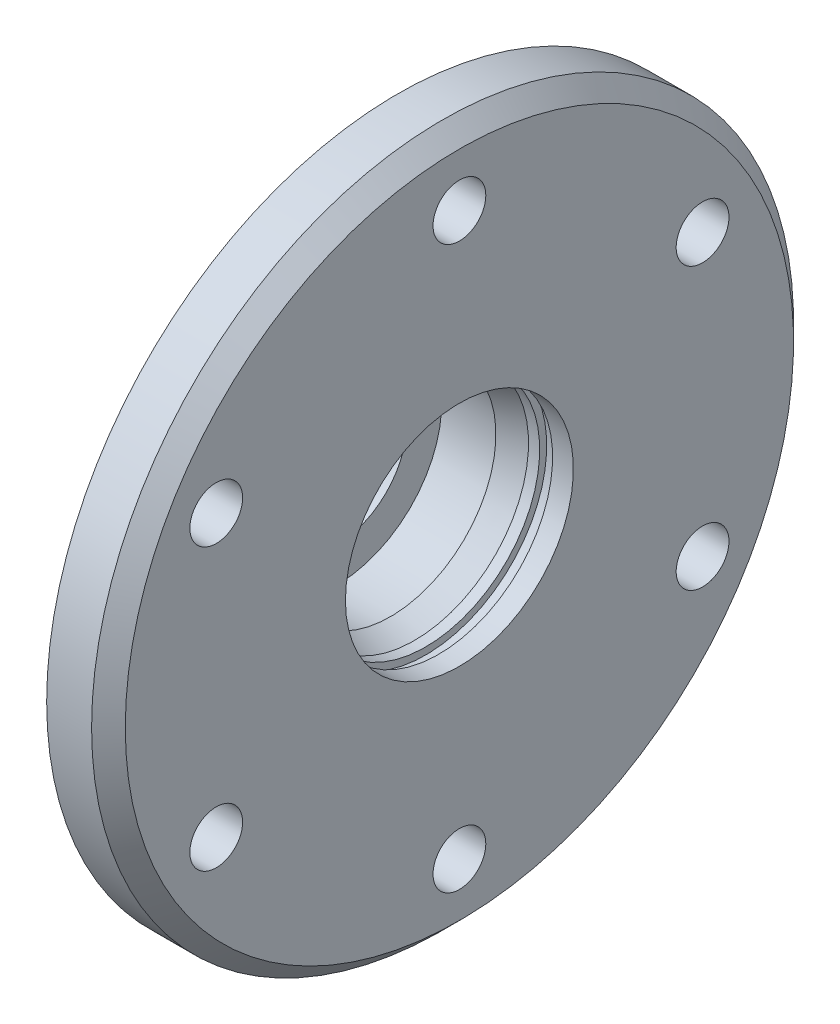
SolidWorks part; units mm, degrees
ref_plane "Plane1" through (0, 0, 0) normal (0, 0, 1) x (1, 0, 0)
ref_plane "Plane2" through (0, 0, 0) normal (0, 1, 0) x (1, 0, 0)
ref_plane "Plane3" through (0, 0, 0) normal (1, 0, 0) x (0, 0, -1)
sketch "Sketch1" plane through (0, 0, 0) normal (0, 0, 1) x (1, 0, 0)
  line L0 (0, 0) -> (20.7635, 0) construction
  line L1 (0, 14.2875) -> (12.3952, 14.2875)
  line L2 (17.9832, 10.3124) -> (17.9832, 31.75)
  line L3 (12.3952, 14.2875) -> (12.3952, 15.875)
  line L4 (3.048, 10.9982) -> (0, 10.9982)
  line L5 (12.3952, 31.75) -> (17.9832, 31.75)
  line L6 (0, 0) -> (20.7635, 0) construction
  line L7 (0, 10.9982) -> (0, 14.2875)
  line L8 (12.3952, 15.875) -> (14.351, 15.875)
  line L9 (3.048, 10.9982) -> (3.048, 6.3754)
  line L10 (3.048, 6.3754) -> (6.858, 6.3754)
  line L11 (6.858, 6.3754) -> (6.858, 9.525)
  line L12 (6.858, 9.525) -> (11.7602, 9.525)
  line L13 (16.1036, 10.3124) -> (17.9832, 10.3124)
  line L14 (11.7602, 9.525) -> (13.9236, 10.3124)
  line L15 (16.1036, 10.3124) -> (16.1036, 10.9474)
  line L16 (16.1036, 10.9474) -> (14.9352, 10.9474)
  line L17 (14.9352, 10.9474) -> (14.9352, 10.3124)
  line L18 (14.9352, 10.3124) -> (13.9236, 10.3124)
  line L19 (14.351, 15.875) -> (14.351, 19.4056)
  line L20 (14.351, 19.4056) -> (12.3952, 19.4056)
  line L21 (12.3952, 19.4056) -> (12.3952, 31.75)
  dimension "D1" = 19.05
  dimension "D2" = 20.6248
  dimension "D3" = 12.7508
  dimension "D4" = 21.8948
  dimension "D5" = 20
  dimension "D6" = 11.1252
  dimension "D7" = 3.048
  dimension "D8" = 1.1684
  dimension "D9" = 4.9022
  dimension "D10" = 3.048
  dimension "D11" = 3.81
  dimension "D12" = 21.9964
  dimension "D13" = 28.575
  dimension "D14" = 5.588
  dimension "D15" = 63.5
  dimension "D16" = 3.048
  dimension "D17" = 1.9558
  dimension "D18" = 31.75
  dimension "D19" = 3.5306
  dimension "D20" = 38.8112
  dimension "D21" = 1.5875
revolve "Base-Revolve" add sketch "Sketch1" angle 360 about L0
fillet "Fillet1" radius 0.127
chamfer "Chamfer1" distance 1.524 angle 45
sketch "Sketch2" plane through (17.9832, 0, 0) normal (1, 0, 0) x (0, 0, -1)
  line L0 (0, 0) -> (0, 25.4) construction
  circle A0 centre (0, 25.4) radius 2.3876
  circle A1 centre (21.997, 12.7) radius 2.3876
  circle A5 centre (21.997, -12.7) radius 2.3876
  circle A6 centre (0, -25.4) radius 2.3876
  circle A7 centre (-21.997, -12.7) radius 2.3876
  circle A8 centre (-21.997, 12.7) radius 2.3876
  dimension "D1" = 4.7752
  dimension "D2" = 25.4
extrude "Cut-Extrude1" cut sketch "Sketch2" against normal through all
